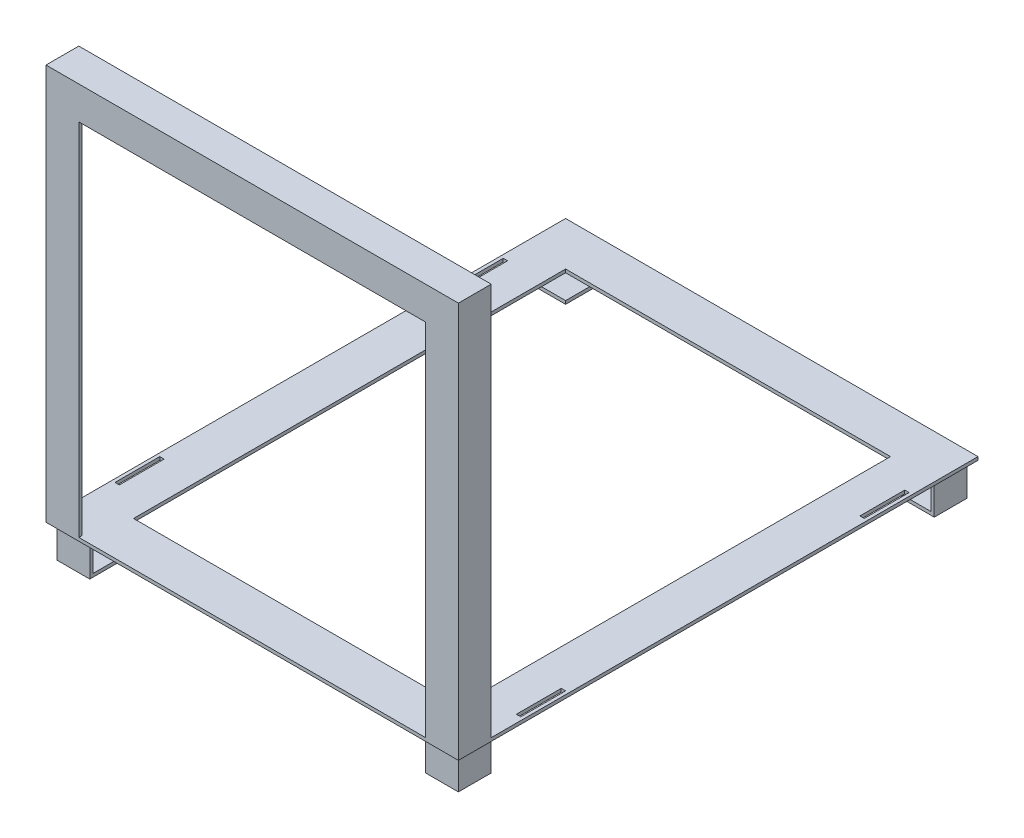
SolidWorks part; units mm, degrees
ref_plane "Front Plane" through (0, 0, 0) normal (0, 0, 1) x (1, 0, 0)
ref_plane "Top Plane" through (0, 0, 0) normal (0, 1, 0) x (1, 0, 0)
ref_plane "Right Plane" through (0, 0, 0) normal (1, 0, 0) x (0, 0, -1)
sketch "Sketch1" plane through (0, 0, 0) normal (0, 1, 0) x (1, 0, 0)
  line L0 (-148.5, 197.5) -> (148.5, 197.5)
  line L1 (-188.5, 237.5) -> (188.5, 237.5)
  line L2 (-188.5, 237.5) -> (-188.5, -237.5)
  line L3 (-188.5, -237.5) -> (188.5, -237.5)
  line L4 (188.5, 237.5) -> (188.5, -237.5)
  line L5 (-188.5, 237.5) -> (188.5, -237.5) construction
  line L6 (-188.5, -237.5) -> (188.5, 237.5) construction
  line L7 (148.5, 197.5) -> (148.5, -197.5)
  line L8 (-148.5, -197.5) -> (148.5, -197.5)
  line L9 (-148.5, 197.5) -> (-148.5, -197.5)
  point P0 (0, 0)
  dimension "D1" = 377
  dimension "D2" = 475
  dimension "D3" = 40
extrude "Boss-Extrude1" add sketch "Sketch1" along normal mid plane 3
sketch "Sketch2" plane through (0, 1.5, 0) normal (0, 1, 0) x (1, 0, 0)
  line L0 (-188.5, -237.5) -> (188.5, -237.5) construction
  line L1 (181.5, -177.5) -> (185.5, -177.5)
  line L2 (181.5, -177.5) -> (181.5, -136.5)
  line L3 (181.5, -136.5) -> (185.5, -136.5)
  line L4 (185.5, -177.5) -> (185.5, -136.5)
  line L5 (181.5, -177.5) -> (185.5, -136.5) construction
  line L6 (181.5, -136.5) -> (185.5, -177.5) construction
  line L7 (181.5, 136.5) -> (185.5, 136.5)
  line L8 (181.5, 136.5) -> (181.5, 177.5)
  line L9 (181.5, 177.5) -> (185.5, 177.5)
  line L10 (185.5, 136.5) -> (185.5, 177.5)
  line L11 (181.5, 136.5) -> (185.5, 177.5) construction
  line L12 (181.5, 177.5) -> (185.5, 136.5) construction
  line L13 (-185.5, -177.5) -> (-181.5, -177.5)
  line L14 (-185.5, -177.5) -> (-185.5, -136.5)
  line L15 (-185.5, -136.5) -> (-181.5, -136.5)
  line L16 (-181.5, -177.5) -> (-181.5, -136.5)
  line L17 (-185.5, -177.5) -> (-181.5, -136.5) construction
  line L18 (-185.5, -136.5) -> (-181.5, -177.5) construction
  line L19 (-185.5, 136.5) -> (-181.5, 136.5)
  line L20 (-185.5, 136.5) -> (-185.5, 177.5)
  line L21 (-185.5, 177.5) -> (-181.5, 177.5)
  line L22 (-181.5, 136.5) -> (-181.5, 177.5)
  line L23 (-185.5, 136.5) -> (-181.5, 177.5) construction
  line L24 (-185.5, 177.5) -> (-181.5, 136.5) construction
  line L25 (188.5, -237.5) -> (188.5, 237.5) construction
  line L26 (-188.5, 237.5) -> (-188.5, -237.5) construction
  line L27 (188.5, 237.5) -> (-188.5, 237.5) construction
  point P0 (183.5, -157)
  point P5 (183.5, 157)
  point P10 (-183.5, -157)
  point P15 (-183.5, 157)
  dimension "D1" = 4
  dimension "D2" = 41
  dimension "D3" = 60
  dimension "D4" = 3
  dimension "D5" = 3
  dimension "D6" = 60
extrude "Cut-Extrude1" cut sketch "Sketch2" against normal blind 3
sketch "Sketch3" plane through (0, -1.5, 0) normal (0, -1, 0) x (1, 0, 0)
  line L0 (-183.5, 232.5) -> (-183.5, 202.5)
  line L1 (-183.5, 202.5) -> (-180.5, 202.5)
  line L2 (-180.5, 202.5) -> (-180.5, 229.5)
  line L3 (-180.5, 229.5) -> (-153.5, 229.5)
  line L4 (-153.5, 229.5) -> (-153.5, 232.5)
  line L5 (-153.5, 232.5) -> (-183.5, 232.5)
  line L6 (153.5, 232.5) -> (183.5, 232.5)
  line L7 (183.5, 232.5) -> (183.5, 202.5)
  line L8 (183.5, 202.5) -> (180.5, 202.5)
  line L9 (180.5, 202.5) -> (180.5, 229.5)
  line L10 (180.5, 229.5) -> (153.5, 229.5)
  line L11 (153.5, 229.5) -> (153.5, 232.5)
  line L12 (-183.5, -202.5) -> (-183.5, -232.5)
  line L13 (-183.5, -232.5) -> (-153.5, -232.5)
  line L14 (-153.5, -232.5) -> (-153.5, -229.5)
  line L15 (-153.5, -229.5) -> (-180.5, -229.5)
  line L16 (-180.5, -229.5) -> (-180.5, -202.5)
  line L17 (-180.5, -202.5) -> (-183.5, -202.5)
  line L18 (153.5, -229.5) -> (153.5, -232.5)
  line L19 (153.5, -232.5) -> (183.5, -232.5)
  line L20 (183.5, -232.5) -> (183.5, -202.5)
  line L21 (183.5, -202.5) -> (180.5, -202.5)
  line L22 (180.5, -202.5) -> (180.5, -229.5)
  line L23 (180.5, -229.5) -> (153.5, -229.5)
  line L24 (-188.5, 237.5) -> (188.5, 237.5) construction
  line L25 (-188.5, -237.5) -> (-188.5, 237.5) construction
  line L26 (188.5, -237.5) -> (-188.5, -237.5) construction
  line L27 (188.5, 237.5) -> (188.5, -237.5) construction
  dimension "D1" = 30
  dimension "D2" = 3
  dimension "D3" = 5
  dimension "D4" = 5
  dimension "D5" = 5
  dimension "D6" = 5
extrude "Boss-Extrude2" add sketch "Sketch3" along normal blind 30
sketch "Sketch4" plane through (0, -31.5, 0) normal (0, -1, 0) x (1, 0, 0)
  line L1 (-183.5, -232.5) -> (-153.5, -232.5)
  line L2 (-183.5, -232.5) -> (-183.5, -202.5)
  line L3 (-183.5, -202.5) -> (-153.5, -202.5)
  line L4 (-153.5, -232.5) -> (-153.5, -202.5)
  line L5 (183.5, -232.5) -> (153.5, -232.5)
  line L6 (183.5, -232.5) -> (183.5, -202.5)
  line L7 (183.5, -202.5) -> (153.5, -202.5)
  line L8 (153.5, -232.5) -> (153.5, -202.5)
  line L9 (183.5, 232.5) -> (153.5, 232.5)
  line L10 (183.5, 232.5) -> (183.5, 202.5)
  line L11 (183.5, 202.5) -> (153.5, 202.5)
  line L12 (153.5, 232.5) -> (153.5, 202.5)
  line L13 (-183.5, 232.5) -> (-153.5, 232.5)
  line L14 (-183.5, 232.5) -> (-183.5, 202.5)
  line L15 (-183.5, 202.5) -> (-153.5, 202.5)
  line L16 (-153.5, 232.5) -> (-153.5, 202.5)
  dimension "D1" = 30
extrude "Boss-Extrude3" add sketch "Sketch4" against normal blind 3
sketch "Sketch5" plane through (0, 1.5, 0) normal (0, 1, 0) x (1, 0, 0)
  line L0 (188.5, -237.5) -> (158.5, -237.5)
  line L1 (-188.5, -237.5) -> (188.5, -237.5) construction
  line L2 (158.5, -237.5) -> (158.5, -234.5)
  line L3 (158.5, -234.5) -> (185.5, -234.5)
  line L4 (185.5, -234.5) -> (185.5, -207.5)
  line L5 (185.5, -207.5) -> (188.5, -207.5)
  line L6 (188.5, -237.5) -> (188.5, 237.5) construction
  line L7 (188.5, -207.5) -> (188.5, -237.5)
  line L8 (-188.5, -237.5) -> (-158.5, -237.5)
  line L9 (-188.5, 237.5) -> (-188.5, -237.5) construction
  line L10 (-158.5, -237.5) -> (-158.5, -234.5)
  line L11 (-158.5, -234.5) -> (-185.5, -234.5)
  line L12 (-185.5, -234.5) -> (-185.5, -207.5)
  line L13 (-185.5, -207.5) -> (-188.5, -207.5)
  line L14 (-188.5, -207.5) -> (-188.5, -237.5)
  dimension "D1" = 30
  dimension "D2" = 3
extrude "Boss-Extrude4" add sketch "Sketch5" along normal blind 359
sketch "Sketch6" plane through (0, 360.5, 0) normal (0, 1, 0) x (1, 0, 0)
  line L1 (-188.5, -207.5) -> (188.5, -207.5)
  line L2 (-188.5, -207.5) -> (-188.5, -237.5)
  line L3 (-188.5, -237.5) -> (188.5, -237.5)
  line L4 (188.5, -207.5) -> (188.5, -237.5)
extrude "Boss-Extrude5" add sketch "Sketch6" against normal blind 3
sketch "Sketch7" plane through (0, 0, 237.5) normal (0, 0, 1) x (1, 0, 0)
  line L0 (188.5, 360.5) -> (188.5, -1.5) construction
  line L1 (-188.5, 360.5) -> (188.5, 360.5)
  line L2 (-188.5, 360.5) -> (-188.5, 330.5)
  line L3 (-188.5, 330.5) -> (188.5, 330.5)
  line L4 (188.5, 360.5) -> (188.5, 330.5)
  dimension "D1" = 30
extrude "Boss-Extrude6" add sketch "Sketch7" against normal blind 3
